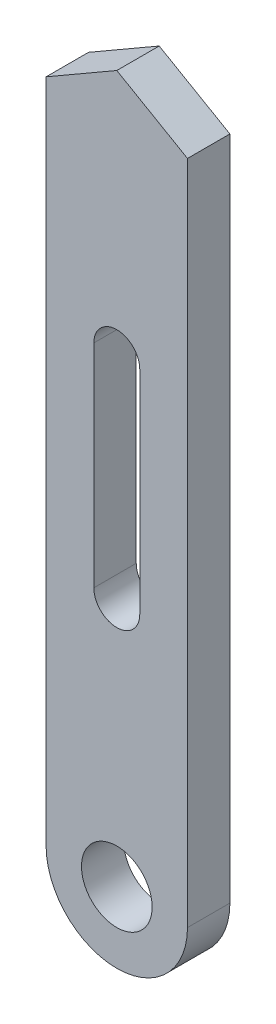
SolidWorks part; units mm, degrees
ref_plane "Front Plane" through (0, 0, 0) normal (0, 0, 1) x (1, 0, 0)
ref_plane "Top Plane" through (0, 0, 0) normal (0, 1, 0) x (1, 0, 0)
ref_plane "Right Plane" through (0, 0, 0) normal (1, 0, 0) x (0, 0, -1)
sketch "Sketch1" plane through (0, 0, 0) normal (0, 0, 1) x (1, 0, 0)
  line L0 (0, 0) -> (0, 126.5731) construction
  line L1 (10, 0) -> (10, 94.2265)
  line L2 (-10, 0) -> (-10, 94.2265)
  line L3 (10, 94.2265) -> (0, 100)
  line L4 (0, 100) -> (-10, 94.2265)
  line L5 (3.25, 65) -> (3.25, 35)
  line L6 (-3.25, 65) -> (-3.25, 35)
  circle A0 centre (0, 0) radius 5
  arc A1 (-10, 0) -> (10, 0) centre (0, 0) ccw
  arc A2 (3.25, 65) -> (-3.25, 65) centre (0, 65) ccw
  arc A3 (-3.25, 35) -> (3.25, 35) centre (0, 35) ccw
  dimension "D1" = 10
  dimension "D2" = 20
  dimension "D6" = 6.5
  dimension "D7" = 35
  dimension "D8" = 30
  dimension "D3" = 100
  dimension "D4" = 120
  dimension "D5" = 120
extrude "Extrude1" add sketch "Sketch1" along normal blind 6
